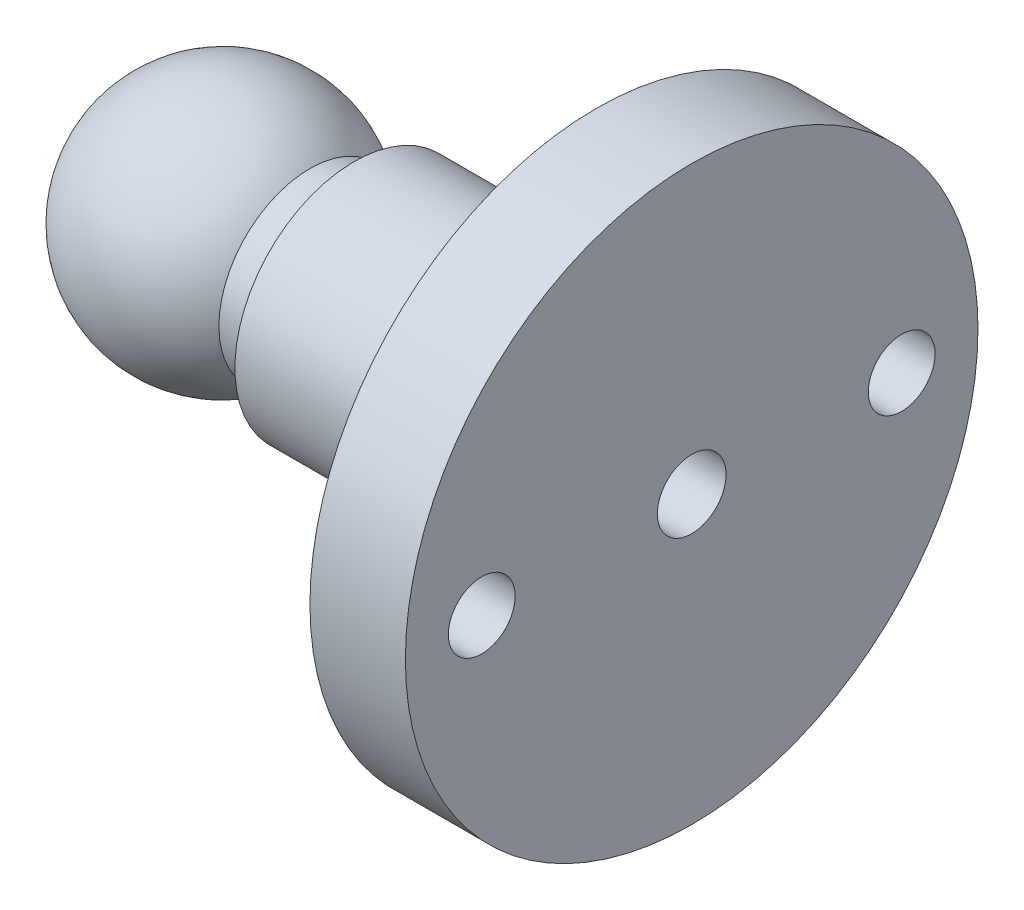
SolidWorks part; units mm, degrees
ref_plane "Front" through (0, 0, 0) normal (0, 0, 1) x (1, 0, 0)
ref_plane "Top" through (0, 0, 0) normal (0, 1, 0) x (1, 0, 0)
ref_plane "Right" through (0, 0, 0) normal (1, 0, 0) x (0, 0, -1)
imported_body "Imported1"
sketch "Sketch2" plane through (282.5233, 0, 0) normal (1, 0, 0) x (0, 0, -1)
  circle A0 centre (0, 92.5161) radius 1.8
extrude "Cut-Extrude1" cut sketch "Sketch2" against normal through all
sketch "Sketch3" plane through (277.5233, 0, 0) normal (-1, 0, 0) x (0, 0, 1)
  circle A0 centre (0, 92.5161) radius 4.7714
extrude "Extrude1" add sketch "Sketch3" along normal blind 15
sketch "Sketch4" plane through (0, 0, 0) normal (0, 0, 1) x (1, 0, 0)
  line L0 (262.5233, 97.1877) -> (262.5233, 96.901)
  line L1 (262.5233, 92.5161) -> (256.723, 92.5161)
  line L2 (262.5233, 97.2875) -> (262.5233, 87.7447) construction
  line L4 (251.6529, 92.5161) -> (251.4529, 92.5161)
  arc A0 (262.5233, 96.901) -> (251.6529, 92.5161) centre (257.9449, 92.5844) ccw
  arc A1 (262.5233, 97.1877) -> (251.4529, 92.5161) centre (257.9449, 92.5844) ccw
  arc A2 (262.6688, 97.0382) -> (262.6688, 88.1306) centre (257.9449, 92.5844) ccw construction
  arc A3 (262.5233, 96.901) -> (262.5233, 88.2678) centre (257.9449, 92.5844) ccw construction
revolve "Revolve1" add sketch "Sketch4" angle 360 about L1
